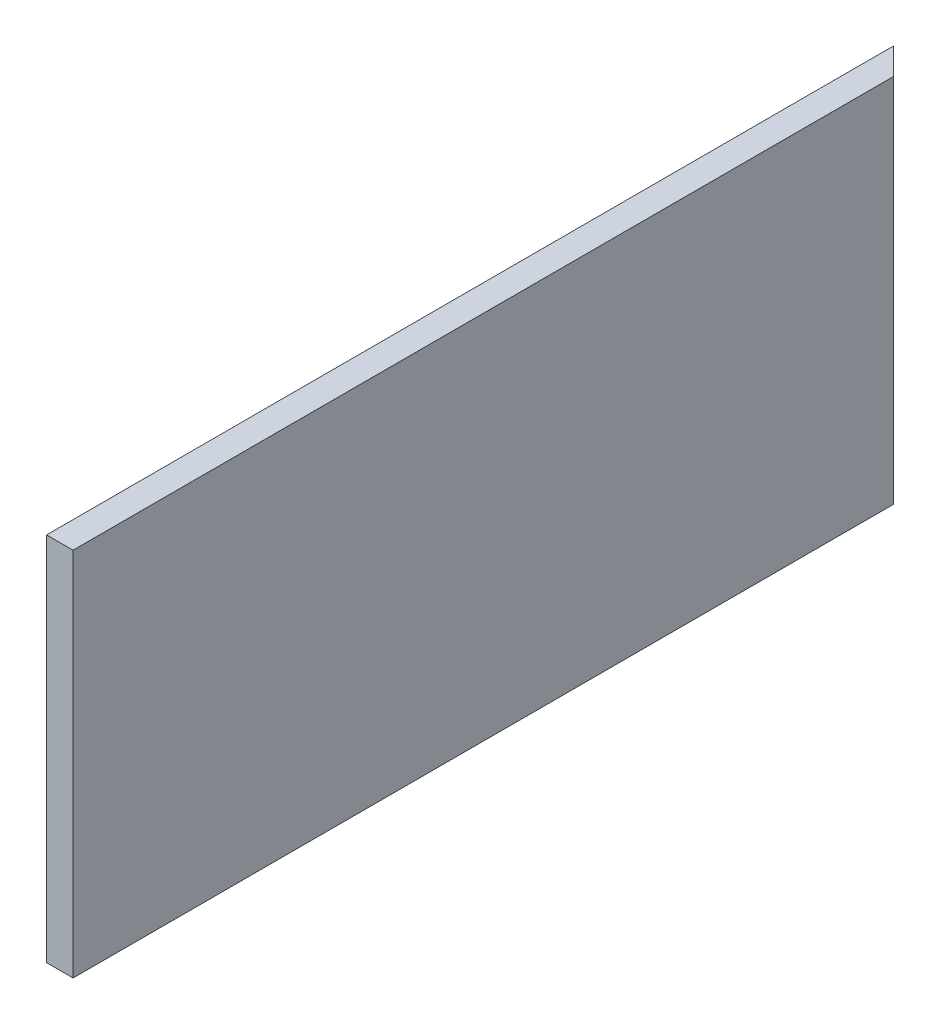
SolidWorks part; units mm, degrees
ref_plane "Front Plane" through (0, 0, 0) normal (0, 0, 1) x (1, 0, 0)
ref_plane "Top Plane" through (0, 0, 0) normal (0, 1, 0) x (1, 0, 0)
ref_plane "Right Plane" through (0, 0, 0) normal (1, 0, 0) x (0, 0, -1)
sketch "Sketch3" plane through (0, 0, 0) normal (0, 1, 0) x (1, 0, 0)
  line L0 (0, 787.4) -> (25.4, 787.4) construction
  line L1 (0, 0) -> (25.4, 0)
  line L2 (0, 0) -> (0, 812.8)
  line L4 (25.4, 0) -> (25.4, 787.4)
  line L7 (25.4, 787.4) -> (0, 812.8)
extrude "Boss-Extrude1" add sketch "Sketch3" along normal blind 355.6
equation "\"system_width\"= 7ft + 10 "
equation "\"system_length\"= 95.5"
equation "\"module_board_length\"= 11.25in"
equation "\"module_board_width\"= 1.5in"
equation "\"module_width\"= (\"system_width\" -  2* \"module_trim_thickness\") / 2"
equation "\"module_length\"= (\"system_top_length\" - \"module_trim_thickness\")/ 2"
equation "\"module_board_long_depth\"= \"module_length\" - \"module_lip_width\""
equation "\"module_board_short_depth\"= \"module_width\" - ( 2 * \"module_board_width\" ) - \"module_lip_width\""
equation "\"module_board_hole\"= 0.5in"
equation "\"module_board_hole_position\"= ( ( \"module_width\" - \"module_board_hole_seperation\" ) / 2 ) + \"module_board_width\"/2"
equation "\"module_board_hole_seperation\"= 20in"
equation "\"module_top_length\"= \"module_length\" + \"module_lip_width\""
equation "\"module_top_width\"= \"module_width\" + \"module_lip_width\""
equation "\"module_top_thickness\"= 0.75in"
equation "\"module_lip_width\"= 1.5in"
equation "\"module_trim_thickness\"= 1in"
equation "\"module_trim_height\"= 14in"
equation "\"D1@Sketch3\"=\"module_length\" + \"module_lip_width\""
equation "\"D3@Sketch3\"=\"module_trim_thickness\""
equation "\"D1@Boss-Extrude1\"=\"module_trim_height\""
equation "\"system_step_width\"= 3ft"
equation "\"system_top_length\"= \"system_length\" - \"system_step_length\""
equation "\"module_top_overhang\"= 4.5in"
equation "\"module_trim_angle\"= 45deg"
equation "\"step_board_length\"= 5.5in"
equation "\"step_board_width\"= 1.5in"
equation "\"system_step_length\"= 2ft+11.5"
equation "\"step_module_width\"= \"module_width\""
equation "\"step_module_length\"= \"system_step_length\" - \"module_trim_thickness\""
equation "\"step_board_long_depth\"= \"step_module_width\" - (2 * \"module_board_width\") - \"module_lip_width\""
equation "\"step_board_short_depth\"= \"step_module_length\" - \"module_lip_width\""
equation "\"step_trim_height\"= 8in"
